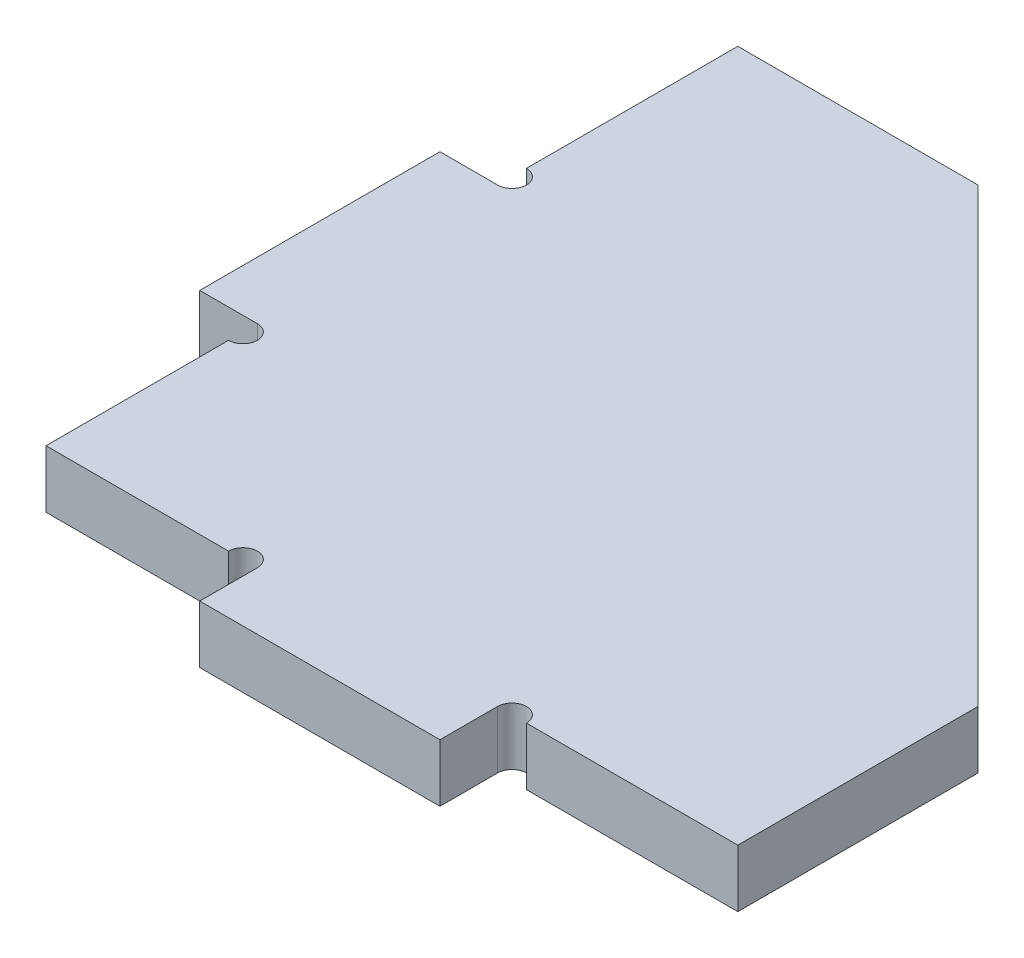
SolidWorks part; units mm, degrees
ref_plane "Front" through (0, 0, 0) normal (0, 0, 1) x (1, 0, 0)
ref_plane "Top" through (0, 0, 0) normal (0, 1, 0) x (1, 0, 0)
ref_plane "Right" through (0, 0, 0) normal (1, 0, 0) x (0, 0, -1)
sketch "Sketch1" plane through (0, 0, 0) normal (0, 1, 0) x (1, 0, 0)
  line L0 (0, 144) -> (0, 100)
  line L1 (0, 0) -> (38, 0)
  line L3 (0, 38) -> (0, 0)
  line L4 (0, 94) -> (-12, 94)
  line L6 (0, 44) -> (-12, 44)
  line L7 (-12, 94) -> (-12, 44)
  line L9 (44, 0) -> (44, -12)
  line L10 (44, -12) -> (94, -12)
  line L11 (94, 0) -> (94, -12)
  line L12 (100, 0) -> (144, 0)
  line L15 (0, 144) -> (50, 144)
  line L16 (50, 144) -> (144, 50)
  line L17 (144, 50) -> (144, 0)
  arc A0 (100, 0) -> (94, 0) centre (97, 0) ccw
  arc A1 (44, 0) -> (38, 0) centre (41, 0) ccw
  arc A2 (0, 38) -> (0, 44) centre (0, 41) ccw
  arc A3 (0, 94) -> (0, 100) centre (0, 97) ccw
extrude "Boss-Extrude1" add sketch "Sketch1" along normal blind 12
equation "\"WoodThickness\"= 12mm"
equation "\"Table Hight\"= 500mm"
equation "\"SlotWidth1\"= 75mm"
equation "\"SlotWidth2\"= 50mm"
equation "\"CoreWidth\"= 150"
equation "\"D3@Sketch1\"=\"SlotWidth2\""
